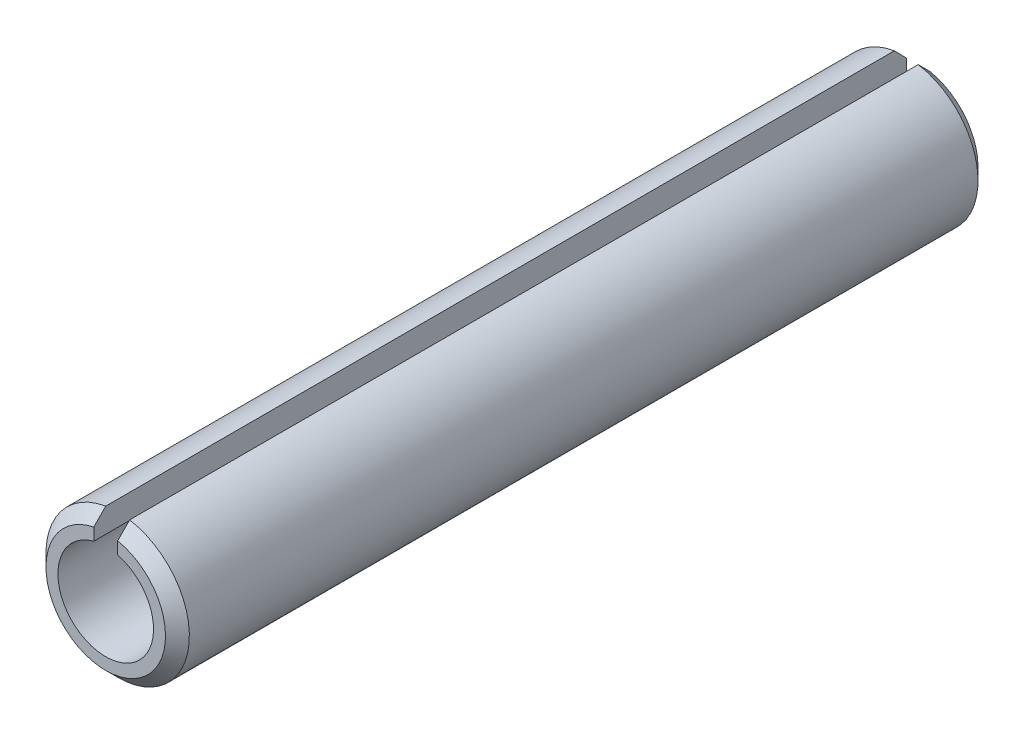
SolidWorks part; units mm, degrees
ref_plane "Plane1" through (0, 0, 0) normal (0, 0, 1) x (1, 0, 0)
ref_plane "Plane2" through (0, 0, 0) normal (0, 1, 0) x (1, 0, 0)
ref_plane "Plane3" through (0, 0, 0) normal (1, 0, 0) x (0, 0, -1)
sketch "Esquisse1" plane through (0, 0, 0) normal (0, 0, 1) x (1, 0, 0)
  circle A0 centre (0, 0) radius 1.5
  dimension "D1" = 3
extrude "Base-Extrusion" add sketch "Esquisse1" along normal blind 17
sketch "Esquisse2" plane through (0, 0, 17) normal (0, 0, 1) x (1, 0, 0)
  circle A0 centre (0, 0) radius 1
  dimension "D1" = 2
extrude "Enlèv. mat.-Extru.1" cut sketch "Esquisse2" against normal blind 17
sketch "Esquisse4" plane through (0, 0, 0) normal (0, 1, 0) x (1, 0, 0)
  line L0 (0, 0) -> (0.25, 0)
  line L1 (0, 0) -> (0, -20)
  line L2 (0.25, -20) -> (0, -20)
  line L3 (0.25, -20) -> (0.25, 0)
  dimension "D1" = 0.25
extrude "Enlèv. mat.-Extru.2" cut sketch "Esquisse4" along normal blind 1.5
sketch "Esquisse5" plane through (0, 0, 0) normal (0, 1, 0) x (1, 0, 0)
  line L0 (0, 0) -> (-0.25, 0)
  line L1 (0, 0) -> (0, -20)
  line L2 (-0.25, -20) -> (0, -20)
  line L3 (-0.25, -20) -> (-0.25, 0)
  dimension "D1" = 0.25
extrude "Enlèv. mat.-Extru.3" cut sketch "Esquisse5" along normal blind 1.5
chamfer "Chanfrein1" distance 0.25 angle 45
chamfer "Chanfrein2" distance 0.25 angle 45
